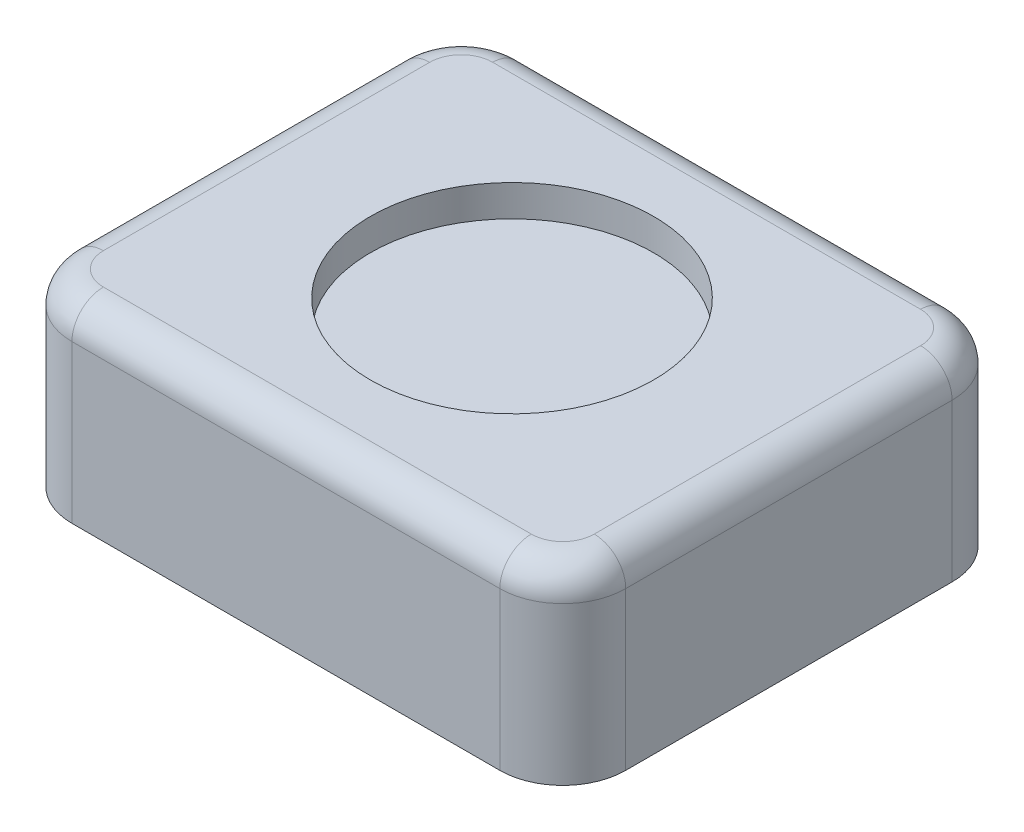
SolidWorks part; units mm, degrees
ref_plane "Front" through (0, 0, 0) normal (0, 0, 1) x (1, 0, 0)
ref_plane "Top" through (0, 0, 0) normal (0, 1, 0) x (1, 0, 0)
ref_plane "Right" through (0, 0, 0) normal (1, 0, 0) x (0, 0, -1)
sketch "Sketch1"
extrude "Extrude1" add sketch "Sketch1" along normal blind 30
fillet "Fillet1" radius 10 4 edges at (0, 15, -71.8233) (87.9513, 15, -71.8233) (87.9513, 15, 0) (0, 15, 0)
fillet "Fillet2" radius 5 8 edges at (2.9289, 30, -2.9289) (0, 30, -35.9117) (2.9289, 30, -68.8944) (43.9756, 30, -71.8233) (85.0224, 30, -68.8944) (87.9513, 30, -35.9117) (85.0224, 30, -2.9289) (43.9756, 30, 0)
sketch "Sketch2"
  dimension "D1" = 45
extrude "Extrude2" cut sketch "Sketch2" against normal blind 5
